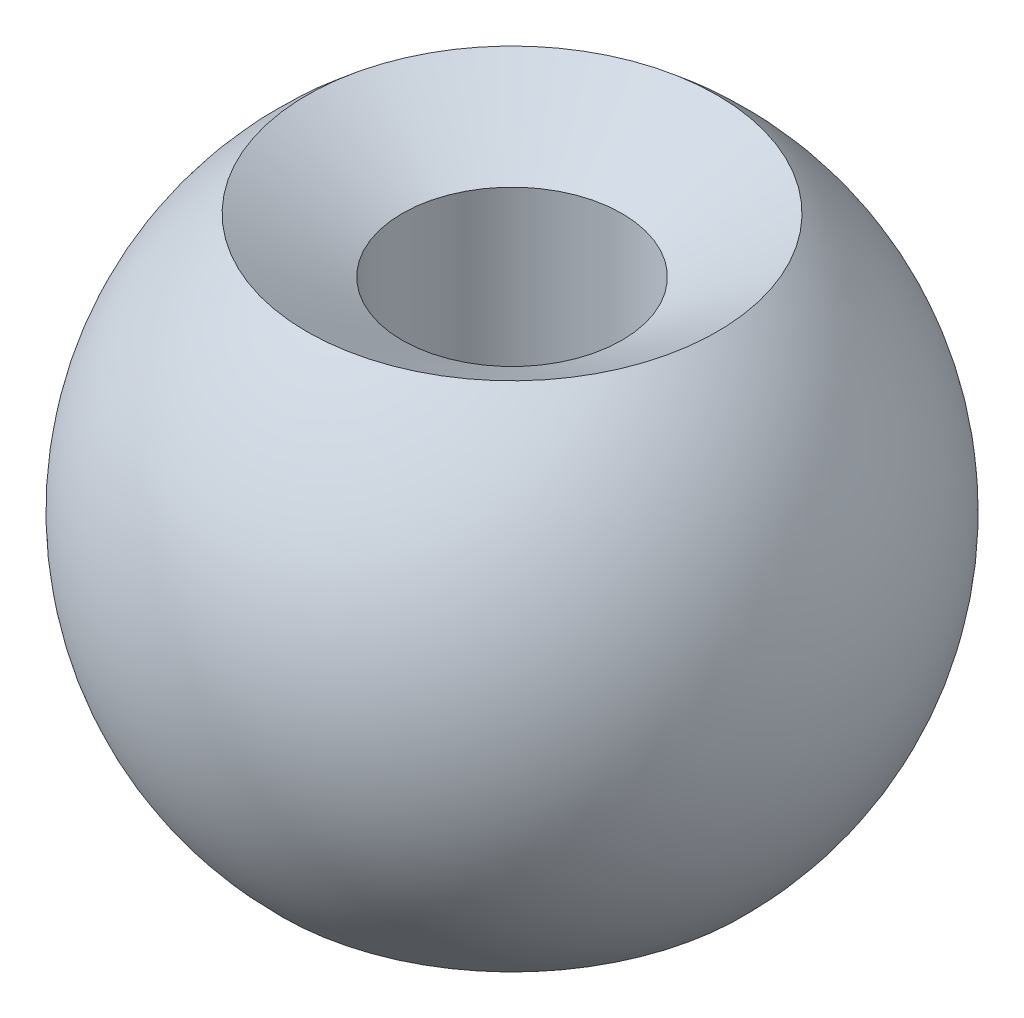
SolidWorks part; units mm, degrees
ref_plane "Front Plane" through (0, 0, 0) normal (0, 0, 1) x (1, 0, 0)
ref_plane "Top Plane" through (0, 0, 0) normal (0, 1, 0) x (1, 0, 0)
ref_plane "Right Plane" through (0, 0, 0) normal (1, 0, 0) x (0, 0, -1)
sketch "Sketch1" plane through (0, 0, 0) normal (0, 0, 1) x (1, 0, 0)
  line L0 (0, 0) -> (0, 9) construction
  line L3 (2, 0) -> (2, 8)
  line L4 (4.1825, 0) -> (2, 0)
  line L5 (2, 0) -> (2, 9) construction
  line L6 (2, 8) -> (3.7321, 9)
  arc A0 (3.7321, 9) -> (4.1825, 0) centre (0, 4.3019) cw
  dimension "D3" = 6
  dimension "D2" = 9
  dimension "D1" = 4
  dimension "D4" = 60
  dimension "D5" = 1
revolve "Revolve1" add sketch "Sketch1" angle 360 about L0
